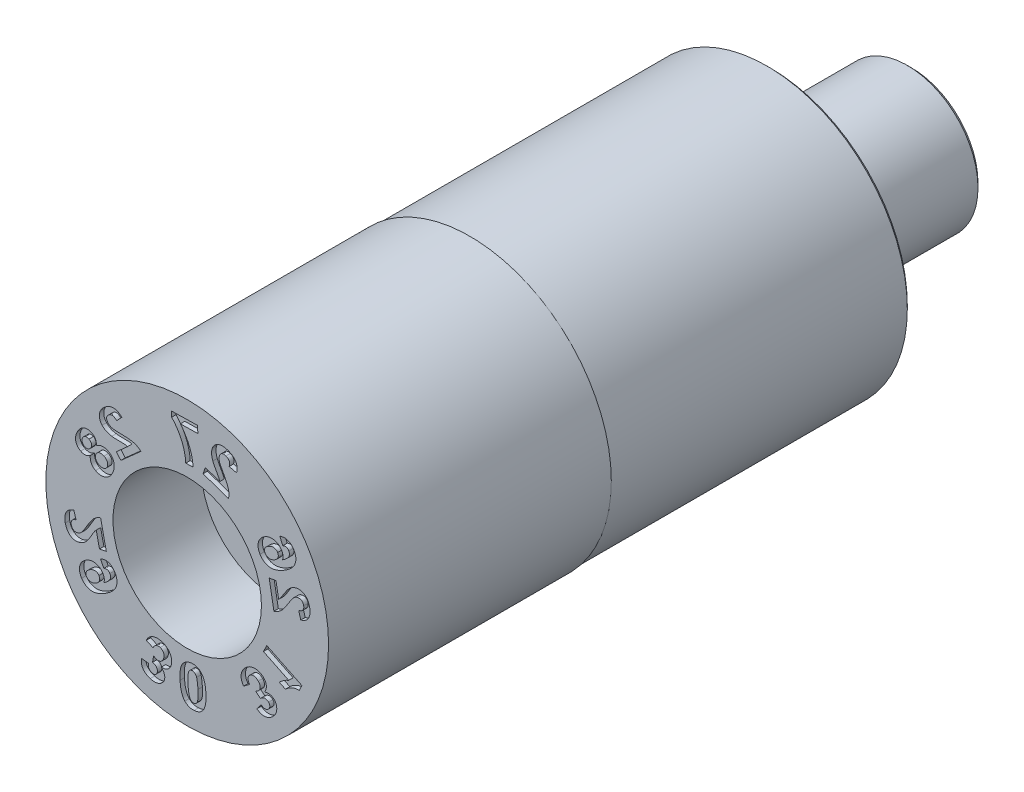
SolidWorks part; units mm, degrees
other "<M8 X 1.25 SHSS>-<Revolve1>"
ref_plane "Front Plane" through (0, 0, 0) normal (0, 0, 1) x (1, 0, 0)
ref_plane "Top Plane" through (0, 0, 0) normal (0, 1, 0) x (1, 0, 0)
ref_plane "Right Plane" through (0, 0, 0) normal (1, 0, 0) x (0, 0, -1)
sketch "Sketch1" plane through (0, 0, 0) normal (1, 0, 0) x (0, 0, -1)
  line L2 (0, 8) -> (0, 4.2)
  line L3 (32.75, 8) -> (0, 8)
  line L4 (-3.7979, 0) -> (49996.2021, 0) construction
  line L8 (25, 1.75) -> (5, 1.75)
  line L9 (5, 4.2) -> (5, 1.75)
  line L10 (5, 4.2) -> (0, 4.2)
  line L12 (33, 4) -> (33, 7.75)
  line L16 (33, 7.75) -> (32.75, 8)
  line L17 (33, 4) -> (25, 4)
  line L18 (25, 1.75) -> (25, 4)
  dimension "D1" = 33
  dimension "D2" = 45
  dimension "D3" = 0.25
  dimension "D4" = 16
  dimension "D5" = 8.4
  dimension "D6" = 5
  dimension "D7" = 3.5
  dimension "D8" = 8
  dimension "D9" = 8
revolve "Revolve1" add sketch "Sketch1" angle 360 about L4
sketch "Sketch4" plane through (0, 0, 0) normal (1, 0, 0) x (0, 0, -1)
  line L0 (0, 0) -> (50000, 0) construction
  line L1 (33, -7.75) -> (33, 7.75) construction
  line L2 (16, 8.935) -> (33, 8.935)
  line L3 (16, 8.935) -> (16, 7.935)
  line L4 (16, 7.935) -> (33, 7.935)
  line L5 (33, 8.935) -> (33, 7.935)
  line L6 (32.75, 8) -> (0, 8) construction
  line L9 (0, 8.8) -> (0, -8.8) construction
  dimension "D1" = 1
  dimension "D2" = 0.065
  dimension "D3" = 16
revolve "Cut-Revolve1" cut sketch "Sketch4" angle 360 about L0
sketch "Sketch2" plane through (0, 0, 0) normal (0, 0, 1) x (1, 0, 0)
  line L0 (0, 0) -> (0, 10.0042) construction
  line L1 (0, 0) -> (8.6639, 5.0021) construction
  line L2 (0, 0) -> (8.6639, -5.0021) construction
  line L3 (0, 0) -> (0, -10.0042) construction
  line L4 (0, 0) -> (-8.6639, -5.0021) construction
  line L5 (0, 0) -> (-8.6639, 5.0021) construction
  circle A0 centre (0, 0) radius 4.9201 construction
  text T0 "26  27  28  29  30  31" font "Arial" height 2.22
  point P11 (0, 0)
  point P1959 (0, 0.0125)
  point P1960 (0.0125, 0.0125)
  point P1961 (0.0125, 0)
  dimension "D1" = 6
extrude "Cut-Extrude1" cut sketch "Sketch2" against normal blind 0.25
sketch "Sketch3" plane through (0, 0, -5) normal (0, 0, 1) x (1, 0, 0)
  line L0 (0, 0) -> (0, 50000) construction
  line L1 (1.0104, 1.75) -> (-1.0104, 1.75)
  line L2 (-1.0104, 1.75) -> (-2.0207, 0)
  line L3 (-2.0207, 0) -> (-1.0104, -1.75)
  line L4 (-1.0104, -1.75) -> (1.0104, -1.75)
  line L5 (1.0104, -1.75) -> (2.0207, 0)
  line L6 (2.0207, 0) -> (1.0104, 1.75)
  line L7 (0, 0) -> (50000, 0) construction
  circle A0 centre (0, 0) radius 1.75 construction
  circle A1 centre (0, 0) radius 1.75 construction
extrude "Cut-Extrude2" cut sketch "Sketch3" against normal blind 4
inserted part "M8 X 1.25 SHSS"
move or copy body "Body-Move/Copy2" placed by mates yes
